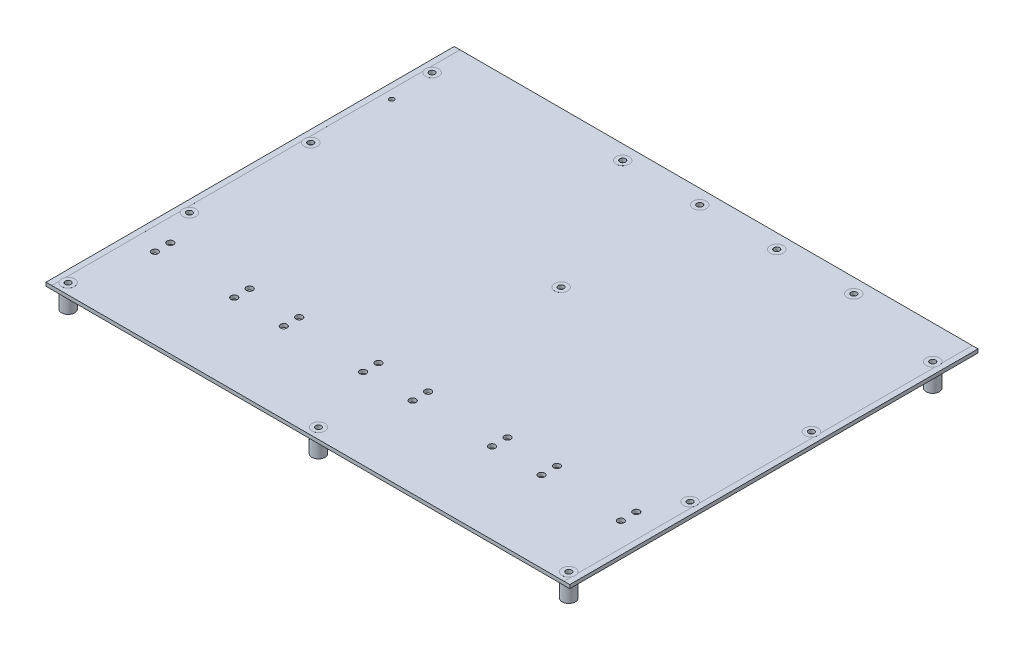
SolidWorks part; units mm, degrees
ref_plane "Front Plane" through (0, 0, 0) normal (0, 0, 1) x (1, 0, 0)
ref_plane "Top Plane" through (0, 0, 0) normal (0, 1, 0) x (1, 0, 0)
ref_plane "Right Plane" through (0, 0, 0) normal (1, 0, 0) x (0, 0, -1)
imported_body "Imported1"
sketch "Sketch1" plane through (0, -0.0127, 0) normal (0, -1, 0) x (1, 0, 0)
  circle A0 centre (165.1, 22.225) radius 1.905 construction
  circle A1 centre (165.1, 22.225) radius 4.318 construction
  circle A2 centre (165.1, 22.225) radius 1.905
  circle A3 centre (165.1, 22.225) radius 4.318
  circle A4 centre (-165.1, 22.225) radius 1.905 construction
  circle A5 centre (-165.1, 22.225) radius 4.318 construction
  circle A6 centre (-165.1, 22.225) radius 1.905
  circle A7 centre (-165.1, 22.225) radius 4.318
  circle A8 centre (-165.1, 262.255) radius 1.905 construction
  circle A9 centre (-165.1, 262.255) radius 4.318 construction
  circle A10 centre (-165.1, 262.255) radius 1.905
  circle A11 centre (-165.1, 262.255) radius 4.318
  circle A12 centre (165.1, 262.255) radius 1.905 construction
  circle A13 centre (165.1, 262.255) radius 4.318 construction
  circle A14 centre (165.1, 262.255) radius 1.905
  circle A15 centre (165.1, 262.255) radius 4.318
  circle A16 centre (-1.27, 9.525) radius 1.905 construction
  circle A17 centre (-1.27, 9.525) radius 4.318 construction
  circle A18 centre (-1.27, 9.525) radius 1.905
  circle A19 centre (-1.27, 9.525) radius 4.318
  circle A20 centre (0, 262.255) radius 1.905 construction
  circle A21 centre (0, 262.255) radius 4.318 construction
  circle A22 centre (0, 262.255) radius 1.905
  circle A23 centre (0, 262.255) radius 4.318
extrude "Extrude1" add sketch "Sketch1" along normal blind 12.7
sketch "Sketch2" plane through (0, 2.3622, 0) normal (0, 1, 0) x (-1, 0, 0)
  line L1 (-168.91, 0) -> (168.91, 0) construction
  line L2 (172.72, 0) -> (172.72, 269.24) construction
  circle A0 centre (163.195, 50.8) radius 1.5875
  dimension "D1" = 3.175
  dimension "D2" = 50.8
  dimension "D3" = 9.525
extrude "Cut-Extrude1" cut sketch "Sketch2" against normal through all
